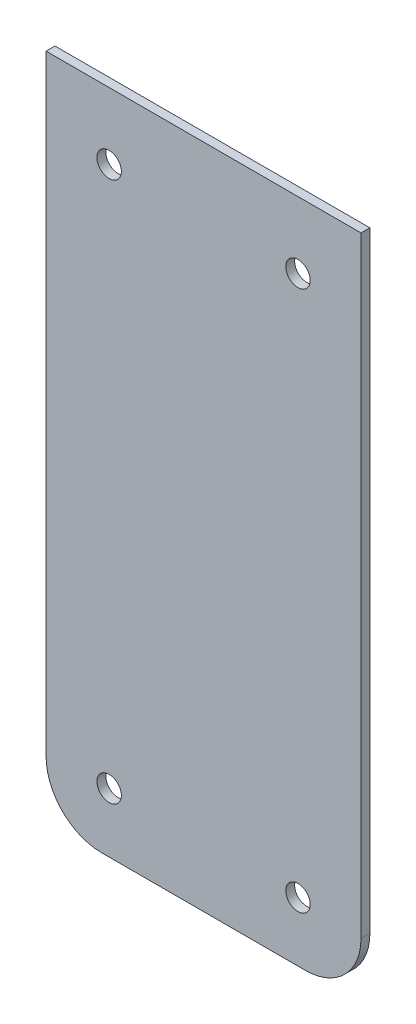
SolidWorks part; units mm, degrees
ref_plane "Front Plane" through (0, 0, 0) normal (0, 0, 1) x (1, 0, 0)
ref_plane "Top Plane" through (0, 0, 0) normal (0, 1, 0) x (1, 0, 0)
ref_plane "Right Plane" through (0, 0, 0) normal (1, 0, 0) x (0, 0, -1)
sketch "Sketch1" plane through (0, 0, 0) normal (0, 0, 1) x (1, 0, 0)
  line L3 (28.35, 60) -> (-28.35, 60)
  line L4 (28.35, 60) -> (28.35, -50)
  line L5 (18.35, -60) -> (-18.35, -60)
  line L6 (-28.35, 60) -> (-28.35, -50)
  line L7 (28.35, 60) -> (-28.35, -60) construction
  line L8 (28.35, -60) -> (-28.35, 60) construction
  arc A0 (18.35, -60) -> (28.35, -50) centre (18.35, -50) ccw
  arc A1 (-28.35, -50) -> (-18.35, -60) centre (-18.35, -50) ccw
  point P0 (0, 0)
  dimension "D3" = 10
  dimension "D1" = 56.7
  dimension "D2" = 120
extrude "Extrude1" add sketch "Sketch1" along normal blind 1.6
sketch "Sketch2" plane through (0, 0, 1.6) normal (0, 0, 1) x (1, 0, 0)
  line L0 (-41.3602, -49.3) -> (43.6808, -49.3) construction
  line L1 (-35.7008, 48) -> (37.601, 48) construction
  line L2 (-18.35, -60) -> (18.35, -60) construction
  circle A0 centre (-17, 48) radius 2.2
  circle A1 centre (17, 48) radius 2.2
  circle A2 centre (-17, -49.3) radius 2.2
  circle A3 centre (17, -49.3) radius 2.2
  dimension "D1" = 4.4
  dimension "D5" = 4.4
  dimension "D7" = 4.4
  dimension "D8" = 4.4
  dimension "D2" = 17
  dimension "D3" = 10.7
  dimension "D4" = 97.3
  dimension "D6" = 17
  dimension "D9" = 17
  dimension "D10" = 17
extrude "Cut-Extrude1" cut sketch "Sketch2" against normal through all
